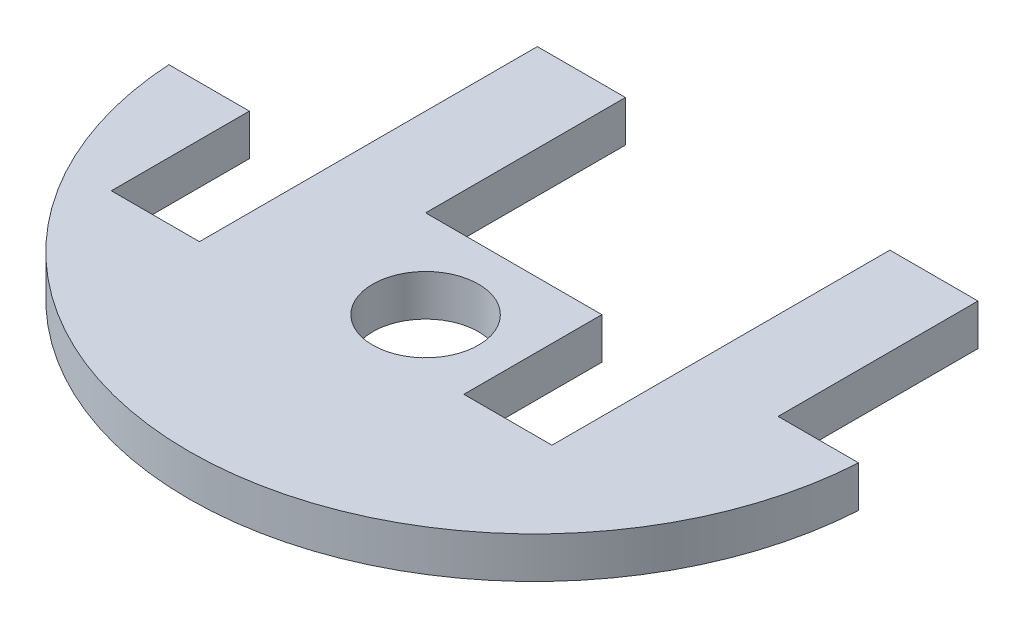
SolidWorks part; units mm, degrees
ref_plane "Front Plane" through (0, 0, 0) normal (0, 0, 1) x (1, 0, 0)
ref_plane "Top Plane" through (0, 0, 0) normal (0, 1, 0) x (1, 0, 0)
ref_plane "Right Plane" through (0, 0, 0) normal (1, 0, 0) x (0, 0, -1)
sketch "Sketch1" plane through (0, 0, 0) normal (0, 1, 0) x (1, 0, 0)
  circle A0 centre (0, 0) radius 24.892
  dimension "D1" = 49.784
extrude "Boss-Extrude1" add sketch "Sketch1" along normal blind 2.9718
sketch "Sketch2" plane through (0, 2.9718, 0) normal (0, 1, 0) x (1, 0, 0)
  line L0 (-27.6658, 0) -> (28.3657, 0) construction
  line L1 (-27.1869, 1.4859) -> (-24.4977, 26.8922)
  line L2 (-27.1869, -1.4859) -> (27.1869, -1.4859)
  line L3 (-27.1869, -1.4859) -> (-27.1869, 1.4859)
  line L5 (27.1869, -1.4859) -> (27.1869, 1.4859)
  line L6 (-27.1869, -1.4859) -> (27.1869, 1.4859) construction
  line L7 (-27.1869, 1.4859) -> (27.1869, -1.4859) construction
  line L8 (-24.4977, 26.8922) -> (2.6524, 27.85)
  line L9 (2.6524, 27.85) -> (25.4187, 24.5714)
  line L10 (25.4187, 24.5714) -> (27.1869, 1.4859)
  point P3 (0, 0)
extrude "Cut-Extrude1" cut sketch "Sketch2" against normal through all
sketch "Sketch3" plane through (0, 2.9718, 0) normal (0, 1, 0) x (1, 0, 0)
  line L0 (0, -24.892) -> (0, 14.6249) construction
  line L1 (-24.8476, -1.4859) -> (24.8476, -1.4859) construction
  line L2 (12.7, -1.4859) -> (19.05, -1.4859)
  line L3 (12.7, -1.4859) -> (12.7, 12.9159)
  line L4 (12.7, 12.9159) -> (19.05, 12.9159)
  line L5 (19.05, -1.4859) -> (19.05, 12.9159)
  line L7 (-6.35, -1.4859) -> (-12.7, -1.4859)
  line L8 (-6.35, -1.4859) -> (-6.35, 12.9159)
  line L9 (-6.35, 12.9159) -> (-12.7, 12.9159)
  line L10 (-12.7, -1.4859) -> (-12.7, 12.9159)
  arc A0 (-24.8476, -1.4859) -> (24.8476, -1.4859) centre (0, 0) ccw construction
extrude "Boss-Extrude2" add sketch "Sketch3" against normal blind 2.9718
sketch "Sketch5" plane through (0, 2.9718, 0) normal (0, 1, 0) x (1, 0, 0)
  line L1 (12.7, -1.4859) -> (6.35, -1.4859)
  line L2 (12.7, -1.4859) -> (12.7, -11.43)
  line L3 (12.7, -11.43) -> (6.35, -11.43)
  line L4 (6.35, -1.4859) -> (6.35, -11.43)
  line L5 (-12.7, -1.4859) -> (-19.05, -1.4859)
  line L6 (-12.7, -1.4859) -> (-12.7, -11.43)
  line L7 (-12.7, -11.43) -> (-19.05, -11.43)
  line L8 (-19.05, -1.4859) -> (-19.05, -11.43)
extrude "Cut-Extrude2" cut sketch "Sketch5" against normal through all
sketch "Sketch6" plane through (0, 2.9718, 0) normal (0, 1, 0) x (1, 0, 0)
  line L0 (6.35, -1.4859) -> (6.35, -11.43) construction
  line L1 (-6.35, -1.4859) -> (6.35, -1.4859) construction
  circle A0 centre (0, -7.8359) radius 3.81
  dimension "D1" = 7.62
  dimension "D2" = 6.35
  dimension "D3" = 6.35
extrude "Cut-Extrude3" cut sketch "Sketch6" against normal through all
sketch "Sketch7" plane through (0, 2.9718, 0) normal (0, 1, 0) x (1, 0, 0)
  line L26 (12.5984, 13.0175) -> (12.5984, -11.3284)
  line L27 (12.5984, -11.3284) -> (6.4516, -11.3284)
  line L28 (6.4516, -11.3284) -> (6.4516, -1.3843)
  line L29 (6.4516, -1.3843) -> (-6.2484, -1.3843)
  line L30 (-6.2484, -1.3843) -> (-6.2484, 13.0175)
  line L31 (-6.2484, 13.0175) -> (-12.8016, 13.0175)
  line L32 (-12.8016, 13.0175) -> (-12.8016, -11.3284)
  line L33 (-12.8016, -11.3284) -> (-18.9484, -11.3284)
  line L34 (-18.9484, -11.3284) -> (-18.9484, -1.3843)
  line L35 (-18.9484, -1.3843) -> (-24.9552, -1.3843)
  line L36 (24.9552, -1.3843) -> (19.1516, -1.3843)
  line L37 (19.1516, -1.3843) -> (19.1516, 13.0175)
  line L38 (19.1516, 13.0175) -> (12.5984, 13.0175)
  line L39 (12.5984, 13.0175) -> (12.5984, -11.3284)
  line L40 (12.5984, -11.3284) -> (6.4516, -11.3284)
  line L41 (6.4516, -11.3284) -> (6.4516, -1.3843)
  line L42 (6.4516, -1.3843) -> (-6.2484, -1.3843)
  line L43 (-6.2484, -1.3843) -> (-6.2484, 13.0175)
  line L44 (-6.2484, 13.0175) -> (-12.8016, 13.0175)
  line L45 (-12.8016, 13.0175) -> (-12.8016, -11.3284)
  line L46 (-12.8016, -11.3284) -> (-18.9484, -11.3284)
  line L47 (-18.9484, -11.3284) -> (-18.9484, -1.3843)
  line L48 (-18.9484, -1.3843) -> (-24.9552, -1.3843)
  line L49 (24.9552, -1.3843) -> (19.1516, -1.3843)
  line L50 (19.1516, -1.3843) -> (19.1516, 13.0175)
  line L51 (19.1516, 13.0175) -> (12.5984, 13.0175)
  arc A2 (-24.9552, -1.3843) -> (24.9552, -1.3843) centre (0, 0) ccw
  arc A3 (-24.9552, -1.3843) -> (24.9552, -1.3843) centre (0, 0) ccw
  circle A5 centre (0, -7.8359) radius 3.7084
  circle A6 centre (0, -7.8359) radius 3.7084
equation "\"D3@Sketch5\"=\"tang\"-\"t\"/2"
equation "\"D4@Sketch5\"=\"tang\"-\"t\"/2"
equation "\"t\"= .117in"
equation "\"kerf\"= .004in"
equation "\"D1@Boss-Extrude1\"=\"t\""
equation "\"D1@Sketch2\"=\"t\""
equation "\"D1@Boss-Extrude2\"=\"t\""
equation "\"D1@Sketch7\"=\"kerf\""
equation "\"D2@Sketch7\"=\"kerf\""
equation "\"tang\"= .45in"
equation "\"D4@Sketch3\"=\"tang\"+\"t\""
equation "\"D3@Sketch3\"=\"tang\"+\"t\""
